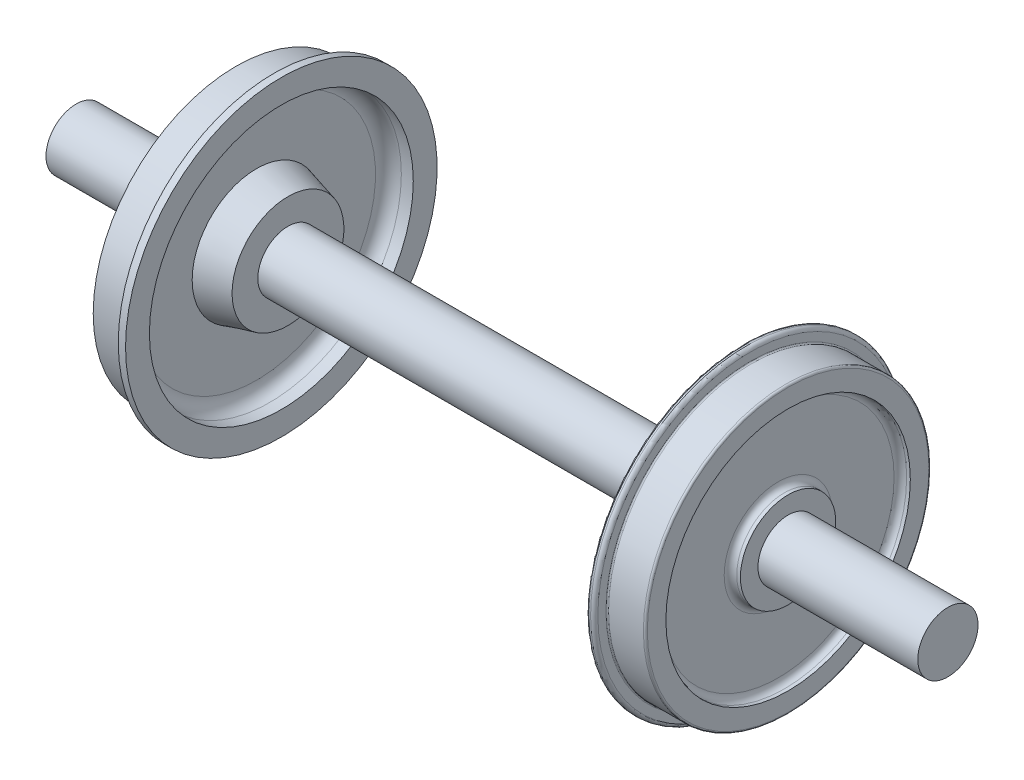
SolidWorks part; units mm, degrees
ref_plane "Face" through (0, 0, 0) normal (0, 0, 1) x (1, 0, 0)
ref_plane "Dessus" through (0, 0, 0) normal (0, 1, 0) x (1, 0, 0)
ref_plane "Droite" through (0, 0, 0) normal (1, 0, 0) x (0, 0, -1)
sketch "Esquisse1" plane through (0, 0, 0) normal (0, 0, 1) x (1, 0, 0)
  line L0 (0, 0) -> (2357.6463, 0) construction
  line L1 (0, 0) -> (0, 1981.5878) construction
  line L2 (-677.5, 90) -> (677.5, 90)
  line L3 (772.5, 208.8017) -> (772.5, 359.3787)
  line L4 (732.5, 399.3787) -> (702.5, 399.3787)
  line L5 (697.5, 404.3787) -> (697.5, 464.3787)
  line L6 (702.5, 469.3787) -> (707.5, 469.3787)
  line L7 (717.5, 459.3787) -> (717.5, 435)
  line L8 (722.5, 430) -> (827.5, 430)
  line L9 (832.5, 425) -> (832.5, 370)
  line L10 (832.5, 90) -> (1315, 90)
  line L11 (1315, 90) -> (1315, 0)
  line L12 (832.5, 143) -> (832.5, 90)
  line L13 (832.5, 370) -> (822.5, 370)
  line L14 (677.5, 168) -> (757.6764, 189.4832)
  line L15 (832.5, 143) -> (822.5, 143)
  line L16 (802.5, 350) -> (802.5, 163)
  line L17 (-677.5, 90) -> (-677.5, 168)
  line L18 (-802.5, 370) -> (-802.5, 143)
  line L19 (-832.5, 143) -> (-802.5, 143)
  line L20 (677.5, 90) -> (677.5, 168)
  line L21 (-677.5, 168) -> (-772.5, 193.4552)
  line L22 (-832.5, 370) -> (-802.5, 370)
  line L23 (-832.5, 143) -> (-832.5, 90)
  line L24 (-1315, 90) -> (-1315, 0)
  line L25 (-832.5, 90) -> (-1315, 90)
  line L26 (-832.5, 430) -> (-832.5, 370)
  line L27 (-717.5, 430) -> (-832.5, 430)
  line L28 (-717.5, 469.3787) -> (-717.5, 430)
  line L29 (-697.5, 469.3787) -> (-717.5, 469.3787)
  line L30 (-697.5, 399.3787) -> (-697.5, 469.3787)
  line L31 (-732.5, 399.3787) -> (-697.5, 399.3787)
  line L32 (-772.5, 193.4552) -> (-772.5, 359.3787)
  arc A0 (732.5, 399.3787) -> (772.5, 359.3787) centre (732.5, 359.3787) cw
  arc A1 (-732.5, 399.3787) -> (-772.5, 359.3787) centre (-732.5, 359.3787) ccw
  arc A2 (802.5, 350) -> (822.5, 370) centre (822.5, 350) cw
  arc A3 (772.5, 208.8017) -> (757.6764, 189.4832) centre (752.5, 208.8017) cw
  arc A4 (822.5, 143) -> (802.5, 163) centre (822.5, 163) cw
  arc A5 (707.5, 469.3787) -> (717.5, 459.3787) centre (707.5, 459.3787) cw
  arc A6 (722.5, 430) -> (717.5, 435) centre (722.5, 435) cw
  arc A7 (832.5, 425) -> (827.5, 430) centre (827.5, 425) ccw
  arc A8 (702.5, 399.3787) -> (697.5, 404.3787) centre (702.5, 404.3787) cw
  arc A9 (697.5, 464.3787) -> (702.5, 469.3787) centre (702.5, 464.3787) cw
  point P23 (0, 0)
  point P41 (0, 90)
  point P43 (802.5, 370)
  point P46 (772.5, 193.4552)
  point P49 (802.5, 143)
  point P52 (717.5, 469.3787)
  point P55 (717.5, 430)
  point P58 (832.5, 430)
  point P61 (697.5, 399.3787)
  point P64 (697.5, 469.3787)
  dimension "D10" = 40
  dimension "D15" = 20
  dimension "D18" = 10
  dimension "D19" = 5
  dimension "D1" = 1435
  dimension "D2" = 115
  dimension "D3" = 860
  dimension "D4" = 180
  dimension "D5" = 20
  dimension "D6" = 180
  dimension "D7" = 2630
  dimension "D8" = 30
  dimension "D9" = 30
  dimension "D11" = 90
  dimension "D12" = 20
  dimension "D13" = 60
  dimension "D14" = 70
  dimension "D16" = 105
  dimension "D17" = 336
  dimension "D21" = 286
revolve "Révol.-Mince1" add sketch "Esquisse1" angle 360 about L0
